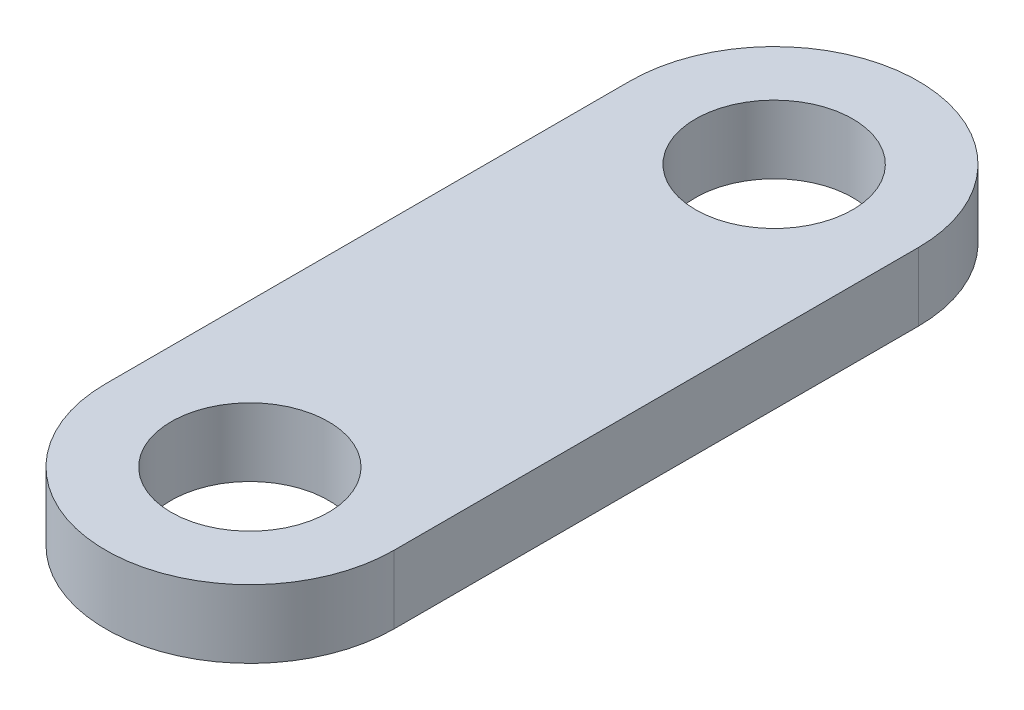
SolidWorks part; units mm, degrees
ref_plane "前视基准面" through (0, 0, 0) normal (0, 0, 1) x (1, 0, 0)
ref_plane "上视基准面" through (0, 0, 0) normal (0, 1, 0) x (1, 0, 0)
ref_plane "右视基准面" through (0, 0, 0) normal (1, 0, 0) x (0, 0, -1)
other "Configuration Table"
sketch "草图1" plane through (0, 0, 0) normal (0, 1, 0) x (1, 0, 0)
  line L0 (-5.5, 10.2603) -> (-5.5, -9.7397)
  line L1 (5.5, -9.7397) -> (5.5, 10.2603)
  arc A0 (-5.5, -9.7397) -> (5.5, -9.7397) centre (0, -9.7397) ccw
  arc A1 (5.5, 10.2603) -> (-5.5, 10.2603) centre (0, 10.2603) ccw
  circle A2 centre (0, 10.2603) radius 3
  circle A3 centre (0, -9.7397) radius 3
  dimension "D3" = 5.5
  dimension "D4" = 6
  dimension "D1" = 20
  dimension "D2" = 20
extrude "凸台-拉伸1" add sketch "草图1" along normal blind 2.6
